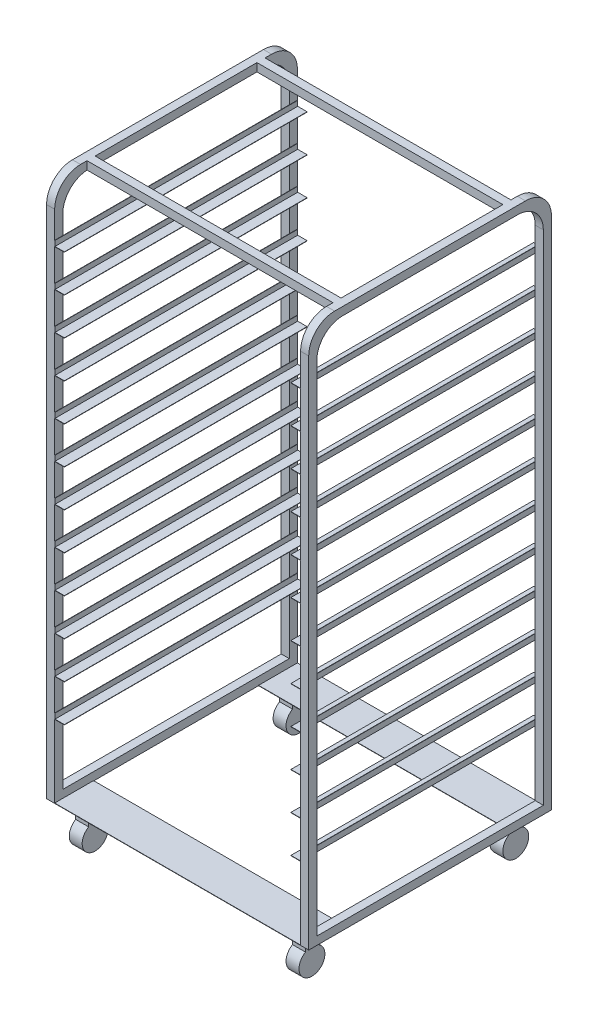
SolidWorks part; units mm, degrees
ref_plane "Plan de face" through (0, 0, 0) normal (0, 0, 1) x (1, 0, 0)
ref_plane "Plan de dessus" through (0, 0, 0) normal (0, 1, 0) x (1, 0, 0)
ref_plane "Plan de droite" through (0, 0, 0) normal (1, 0, 0) x (0, 0, -1)
sketch "Esquisse1" plane through (0, 0, 0) normal (0, 1, 0) x (1, 0, 0)
  line L0 (0, 0) -> (0, 800.441) construction
  line L1 (-405, 0) -> (405, 0)
  line L2 (-405, 0) -> (-405, 750)
  line L3 (-405, 750) -> (405, 750)
  line L4 (405, 0) -> (405, 750)
  dimension "D1" = 810
  dimension "D2" = 750
extrude "Extrusion1" add sketch "Esquisse1" along normal blind 25
sketch "Esquisse2" plane through (0, 25, 0) normal (0, 1, 0) x (1, 0, 0)
  line L0 (-405, 0) -> (405, 0) construction
  line L1 (-380, 0) -> (380, 0)
  line L2 (-380, 0) -> (-380, 750)
  line L3 (-380, 750) -> (380, 750)
  line L4 (380, 0) -> (380, 750)
  line L5 (405, 750) -> (-405, 750) construction
  line L6 (405, 0) -> (405, 750) construction
  line L7 (-405, 750) -> (-405, 0) construction
  line L8 (0, 801.085) -> (0, 10.3886) construction
  dimension "D1" = 25
  dimension "D2" = 25
extrude "Extrusion2" cut sketch "Esquisse2" against normal blind 24
sketch "Esquisse3" plane through (0, 1, 0) normal (0, 1, 0) x (1, 0, 0)
  line L0 (-380, 750) -> (-380, 0) construction
  line L1 (-380, 120) -> (380, 120)
  line L2 (-380, 120) -> (-380, 630)
  line L3 (-380, 630) -> (380, 630)
  line L4 (380, 120) -> (380, 630)
  line L5 (-380, 0) -> (380, 0) construction
  line L6 (380, 750) -> (-380, 750) construction
  line L7 (380, 0) -> (380, 750) construction
  dimension "D1" = 120
  dimension "D2" = 120
  dimension "D3" = 0
extrude "Extrusion3" cut sketch "Esquisse3" against normal through all
sketch "Esquisse4" plane through (0, 25, 0) normal (0, 1, 0) x (1, 0, 0)
  line L0 (380, 0) -> (380, 750) construction
  line L1 (405, 0) -> (380, 0)
  line L2 (405, 0) -> (405, 25)
  line L3 (405, 25) -> (380, 25)
  line L4 (380, 0) -> (380, 25)
  dimension "D1" = 25
extrude "Extrusion4" add sketch "Esquisse4" along normal blind 1645
pattern_linear "Répétition linéaire1" count 2 spacing 725 along (0, 0, -1) of "Extrusion4"
pattern_linear "Répétition linéaire2" count 2 spacing 785 along (-1, 0, 0) of "Répétition linéaire1", "Extrusion4"
sketch "Esquisse5" plane through (0, 0, -25) normal (0, 0, -1) x (-1, 0, 0)
  line L0 (-380, 1670) -> (-380, 25) construction
  line L1 (-405, 1670) -> (-380, 1670)
  line L2 (-405, 1670) -> (-405, 1645)
  line L3 (-405, 1645) -> (-380, 1645)
  line L4 (-380, 1670) -> (-380, 1645)
  dimension "D1" = 25
extrude "Extrusion5" add sketch "Esquisse5" along normal up to next
pattern_linear "Répétition linéaire3" count 2 spacing 785 along (-1, 0, 0) of "Extrusion5"
sketch "Esquisse6" plane through (-380, 0, 0) normal (1, 0, 0) x (0, 0, -1)
  line L0 (725, 1645) -> (25, 1645) construction
  line L1 (100, 1670) -> (125, 1670)
  line L2 (100, 1670) -> (100, 1645)
  line L3 (100, 1645) -> (125, 1645)
  line L4 (125, 1670) -> (125, 1645)
  line L5 (0, 1) -> (0, 1670) construction
  dimension "D1" = 25
  dimension "D2" = 25
  dimension "D3" = 0
  dimension "D4" = 100
extrude "Extrusion6" add sketch "Esquisse6" along normal up to next
pattern_linear "Répétition linéaire4" count 2 spacing 525 along (0, 0, -1) of "Extrusion6"
sketch "Esquisse7" plane through (0, 0, 0) normal (0, -1, 0) x (1, 0, 0)
  line L0 (-405, 0) -> (405, 0) construction
  line L1 (315, 0) -> (355, 0)
  line L2 (315, 0) -> (315, -120)
  line L3 (315, -120) -> (355, -120)
  line L4 (355, 0) -> (355, -120)
  line L5 (-380, -120) -> (380, -120) construction
  line L6 (405, 0) -> (405, -750) construction
  dimension "D1" = 40
  dimension "D2" = 50
extrude "Extrusion7" add sketch "Esquisse7" along normal blind 125
pattern_linear "Répétition linéaire5" count 2 spacing 670 along (-1, 0, 0) of "Extrusion7"
pattern_linear "Répétition linéaire6" count 2 spacing 630 along (0, 0, -1) of "Répétition linéaire5", "Extrusion7"
sketch "Esquisse8" plane through (-380, 0, 0) normal (1, 0, 0) x (0, 0, -1)
  line L0 (0, 1) -> (0, 1670) construction
  line L1 (0, 226) -> (750, 226)
  line L2 (0, 226) -> (0, 225)
  line L3 (0, 225) -> (750, 225)
  line L4 (750, 226) -> (750, 225)
  line L5 (750, 1) -> (750, 1670) construction
  line L6 (750, 0) -> (0, 0) construction
  dimension "D1" = 1
  dimension "D2" = 225
extrude "Extrusion8" add sketch "Esquisse8" along normal blind 30
pattern_linear "Répétition linéaire9" count 12 spacing 115 along (0, 1, 0) of "Extrusion8"
sketch "Esquisse10" plane through (0, 226, 0) normal (0, 1, 0) x (-1, 0, 0)
  line L0 (350, -750) -> (380, -750) construction
  line L1 (380, 0) -> (379, 0)
  line L2 (380, 0) -> (380, -750)
  line L3 (380, -750) -> (379, -750)
  line L4 (379, 0) -> (379, -750)
  dimension "D1" = 1
extrude "Extrusion10" add sketch "Esquisse10" along normal blind 16
pattern_linear "Répétition linéaire10" count 12 spacing 115 along (0, 1, 0) of "Extrusion10"
pattern_linear "Répétition linéaire11" count 2 spacing 730 along (1, 0, 0) of "Répétition linéaire9", "Extrusion8"
pattern_linear "Répétition linéaire12" count 2 spacing 759 along (1, 0, 0) of "Répétition linéaire10", "Extrusion10"
sketch "Esquisse12" plane through (355, 0, 0) normal (1, 0, 0) x (0, 0, -1)
  line L0 (0, -125) -> (0, 0) construction
  line L1 (120, -125) -> (0, -125) construction
  line L2 (120, 0) -> (0, 0) construction
  line L3 (40, 0) -> (0, 0)
  line L4 (40, 0) -> (40, -50.359)
  line L5 (0, 0) -> (0, -140)
  line L6 (80, 0) -> (80, -50.359)
  line L7 (80, 0) -> (120, 0)
  line L8 (120, 0) -> (120, -140)
  line L9 (0, -140) -> (120, -140)
  arc A0 (40, -50.359) -> (80, -50.359) centre (60, -85) ccw
  dimension "D1" = 80
  dimension "D3" = 40
  dimension "D2" = 60
  dimension "D4" = 40
  dimension "D5" = 140
  dimension "D6" = 140
extrude "Extrusion11" cut sketch "Esquisse12" against normal through all
pattern_linear "Répétition linéaire13" count 2 spacing 630 along (0, 0, -1) of "Extrusion11"
fillet "Congé1" radius 80 14 edges at (-392.5, 1645, -725) (-380, 1645, -687.5) (-392.5, 1645, -25) (-380, 1645, -62.5) (380, 1645, -62.5) (0, 1645, -100) (0, 1645, -650) (392.5, 1670, 0) (392.5, 1670, -750) (-392.5, 1670, 0) (-392.5, 1670, -750) (392.5, 1645, -725) (392.5, 1645, -25) (380, 1645, -687.5)
